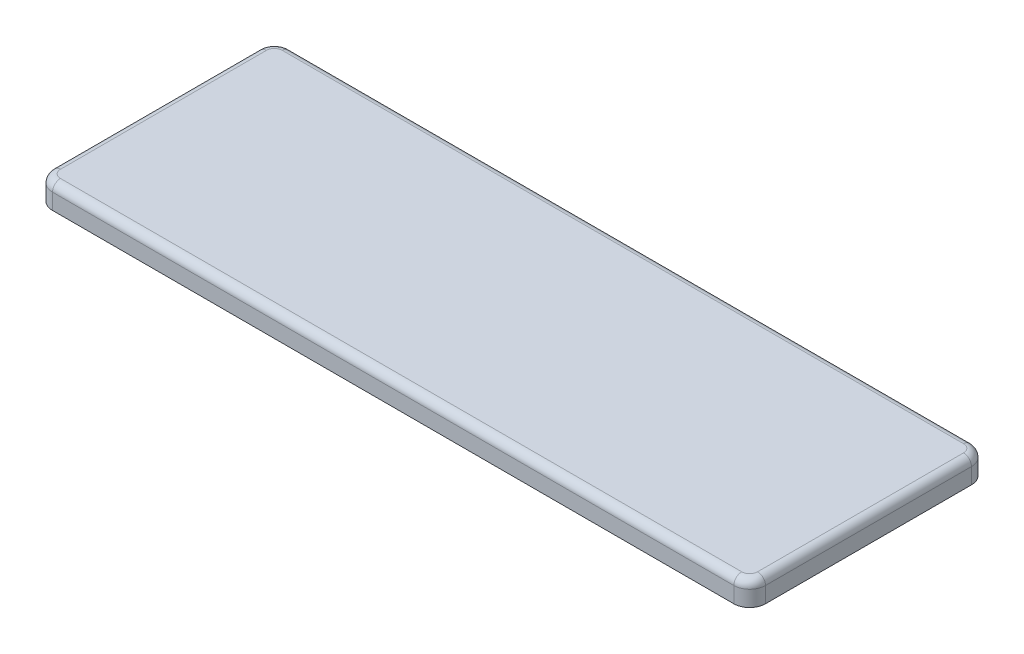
SolidWorks part; units mm, degrees
ref_plane "正面" through (0, 0, 0) normal (0, 0, 1) x (1, 0, 0)
ref_plane "平面" through (0, 0, 0) normal (0, 1, 0) x (1, 0, 0)
ref_plane "右側面" through (0, 0, 0) normal (1, 0, 0) x (0, 0, -1)
sketch "ｽｹｯﾁ1" plane through (0, 0, 0) normal (0, 1, 0) x (0, 0, -1)
  line L1 (-13, 45) -> (13, 45)
  line L2 (-15, 43) -> (-15, -43)
  line L3 (-13, -45) -> (13, -45)
  line L4 (15, 43) -> (15, -43)
  arc A0 (15, 43) -> (13, 45) centre (13, 43) ccw
  arc A1 (13, -45) -> (15, -43) centre (13, -43) ccw
  arc A2 (-15, -43) -> (-13, -45) centre (-13, -43) ccw
  arc A3 (-13, 45) -> (-15, 43) centre (-13, 43) ccw
  point P7 (15, 45)
  point P10 (15, -45)
  point P15 (-15, 45)
  dimension "D5" = 2
  dimension "D1" = 15
  dimension "D2" = 30
  dimension "D3" = 45
  dimension "D4" = 90
extrude "押し出し1" add sketch "ｽｹｯﾁ1" along normal mid plane 3
fillet "ﾌｨﾚｯﾄ1" radius 1 8 edges at (-44.4142, 1.5, 14.4142) (-45, 1.5, 0) (-44.4142, 1.5, -14.4142) (0, 1.5, -15) (44.4142, 1.5, -14.4142) (45, 1.5, 0) (44.4142, 1.5, 14.4142) (0, 1.5, 15)
sketch "ｽｹｯﾁ2" plane through (0, -1.5, 0) normal (0, -1, 0) x (1, 0, 0)
  line L1 (-43, 13.2) -> (43, 13.2)
  line L2 (-43.2, 13) -> (-43.2, -13)
  line L3 (-43, -13.2) -> (43, -13.2)
  line L4 (43.2, 13) -> (43.2, -13)
  arc A0 (-43, 13.2) -> (-43.2, 13) centre (-43, 13) ccw
  arc A1 (43.2, 13) -> (43, 13.2) centre (43, 13) ccw
  arc A2 (43, -13.2) -> (43.2, -13) centre (43, -13) ccw
  arc A3 (-43.2, -13) -> (-43, -13.2) centre (-43, -13) ccw
  point P7 (-43.2, 13.2)
  point P10 (43.2, 13.2)
  point P13 (43.2, -13.2)
  dimension "D5" = 0.2
  dimension "D1" = 43.2
  dimension "D2" = 86.4
  dimension "D3" = 13.2
  dimension "D4" = 26.4
extrude "押し出し2" cut sketch "ｽｹｯﾁ2" against normal blind 1
sketch "ｽｹｯﾁ4" plane through (0, -0.5, 0) normal (0, -1, 0) x (1, 0, 0)
  line L0 (-45, -13) -> (-45, 13) construction
  line L1 (-31.65, 2.45) -> (-28.35, 2.45)
  line L2 (-31.65, 2.45) -> (-31.65, -2.45)
  line L3 (-31.65, -2.45) -> (-28.35, -2.45)
  line L4 (-28.35, 2.45) -> (-28.35, -2.45)
  line L5 (45, 13) -> (45, -13) construction
  line L6 (28.35, -2.45) -> (31.65, -2.45)
  line L7 (28.35, -2.45) -> (28.35, 2.45)
  line L8 (28.35, 2.45) -> (31.65, 2.45)
  line L9 (31.65, -2.45) -> (31.65, 2.45)
  line L11 (-1.65, 2.45) -> (1.65, 2.45)
  line L12 (-1.65, 2.45) -> (-1.65, -2.45)
  line L13 (-1.65, -2.45) -> (1.65, -2.45)
  line L14 (1.65, 2.45) -> (1.65, -2.45)
  dimension "D1" = 3.3
  dimension "D2" = 4.9
  dimension "D3" = 13.35
  dimension "D4" = 2.45
  dimension "D5" = 3.3
  dimension "D6" = 2.45
  dimension "D7" = 4.9
  dimension "D8" = 13.35
  dimension "D9" = 3.3
  dimension "D10" = 1.65
extrude "押し出し4" add sketch "ｽｹｯﾁ4" along normal blind 8 draft 0.6
fillet "ﾌｨﾚｯﾄ2" radius 0.8 12 edges at (-30, -8.5, 2.3662) (-28.4338, -8.5, 0) (-30, -8.5, -2.3662) (-31.5662, -8.5, 0) (30, -8.5, 2.3662) (31.5662, -8.5, 0) (30, -8.5, -2.3662) (28.4338, -8.5, 0) (0, -8.5, 2.3662) (1.5662, -8.5, 0) (0, -8.5, -2.3662) (-1.5662, -8.5, 0)
